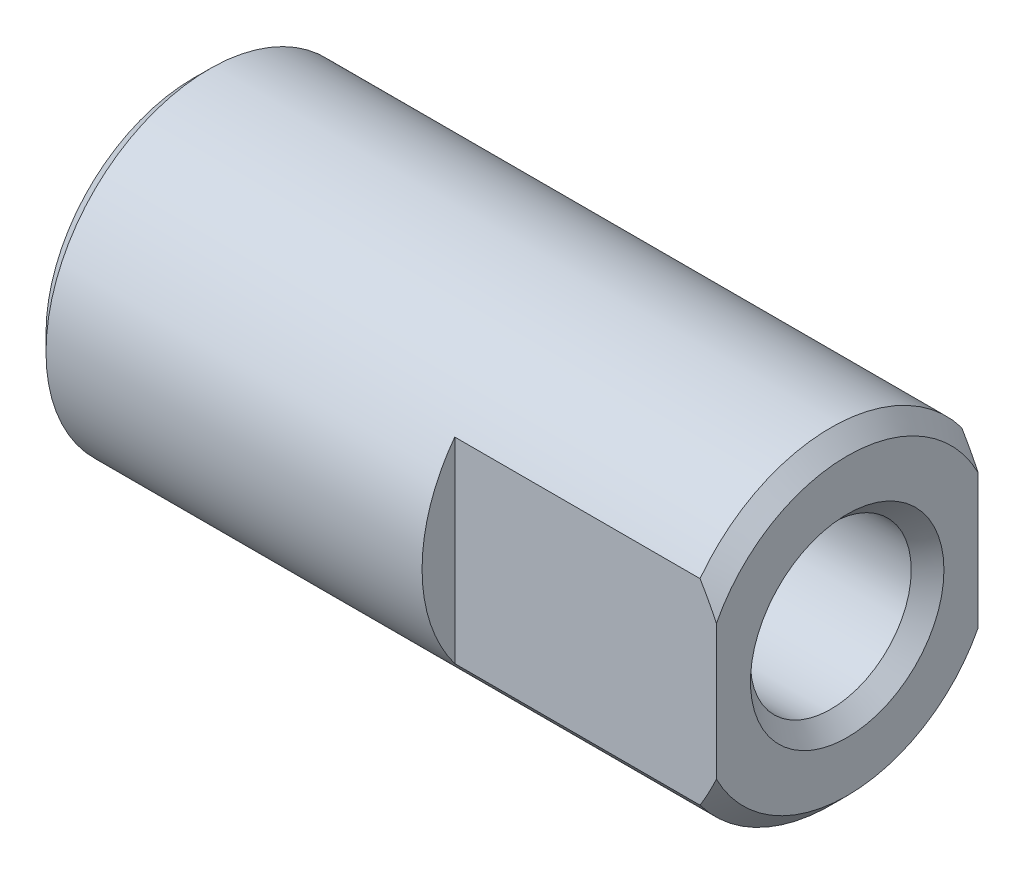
SolidWorks part; units mm, degrees
ref_plane "Front Plane" through (0, 0, 0) normal (0, 0, 1) x (1, 0, 0)
ref_plane "Top Plane" through (0, 0, 0) normal (0, 1, 0) x (1, 0, 0)
ref_plane "Right Plane" through (0, 0, 0) normal (1, 0, 0) x (0, 0, -1)
ref_plane "Plane1" through (0, 0, 0) normal (0, 0, -1) x (-1, 0, 0)
sketch "Sketch1" plane through (0, 0, 0) normal (0, 0, -1) x (-1, 0, 0)
  line L0 (-20, 5) -> (-20, 0)
  line L1 (-20, 0) -> (0, 0)
  line L2 (0, 0) -> (0, 5)
  line L3 (0, 5) -> (-20, 5)
  line L4 (-20, 0) -> (0, 0) construction
revolve "Revolve1" add sketch "Sketch1" angle 360 about L4
sketch "Sketch2" plane through (20, 0, 0) normal (1, 0, 0) x (0, 0, -1)
  line L0 (4, 3) -> (4, -3)
  arc A0 (4, -3) -> (4, 3) centre (0, 0) ccw
extrude "Cut-Extrude1" cut sketch "Sketch2" against normal blind 8
sketch "Sketch3" plane through (20, 0, 0) normal (1, 0, 0) x (0, 0, -1)
  line L0 (-4, -3) -> (-4, 3)
  arc A0 (-4, 3) -> (-4, -3) centre (0, 0) ccw
extrude "Cut-Extrude2" cut sketch "Sketch3" against normal blind 8
hole_wizard "Hole1" positions "Sketch5" profile "Sketch4" legacy
sketch "Sketch5" plane through (20, 0, 0) normal (1, 0, 0) x (0, 0, -1)
  point P0 (0, 0)
sketch "Sketch4" plane through (20, 0, 0) normal (0, 1, 0) x (0, 0, -1)
  line L0 (0, 0) -> (0, 20)
  line L1 (0, 20) -> (2.4585, 20)
  line L2 (2.4585, 20) -> (2.4585, 0)
  line L3 (2.4585, 0) -> (0, 0)
  line L4 (0, 110) -> (0, -10) construction
  dimension "Diameter" = 4.917
  dimension "Depth" = 20
chamfer "Chamfer1" distance 0.5 angle 45 5 edges at (20, 5, 0) (20, -5, 0) (0, 0, -2.4585) (20, 0, -2.4585) (0, 0, 5)
